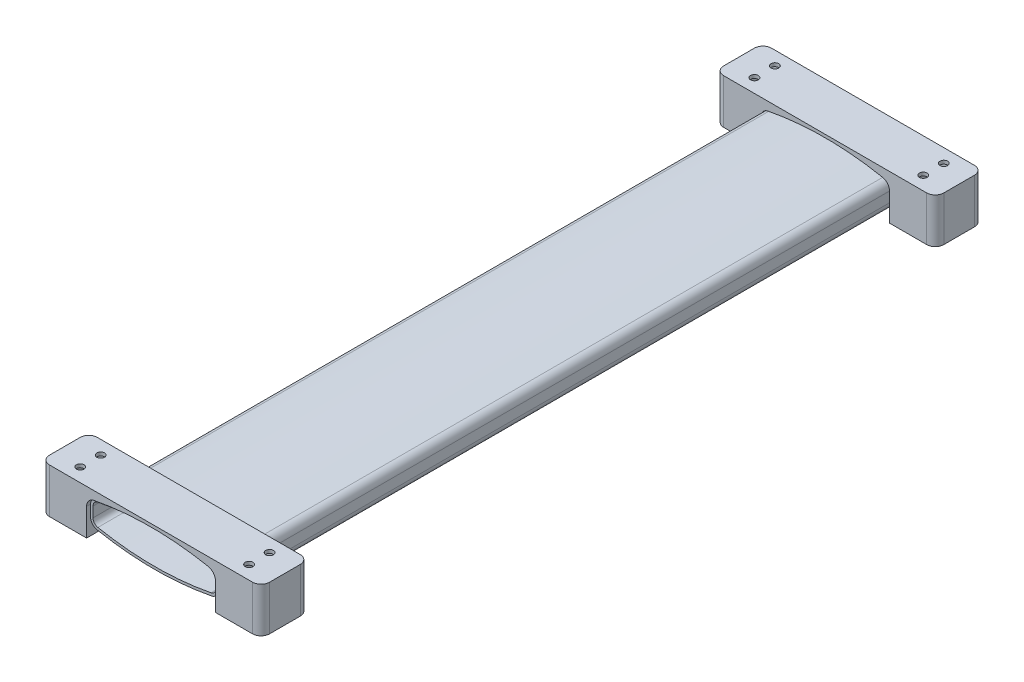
SolidWorks part; units mm, degrees
ref_plane "Front Plane" through (0, 0, 0) normal (0, 0, 1) x (1, 0, 0)
ref_plane "Top Plane" through (0, 0, 0) normal (0, 1, 0) x (1, 0, 0)
ref_plane "Right Plane" through (0, 0, 0) normal (1, 0, 0) x (0, 0, -1)
sketch "Sketch1" plane through (0, 0, 0) normal (0, 0, 1) x (1, 0, 0)
  line L0 (-26.375, 0) -> (26.375, 0) construction
  line L1 (-26.375, 11.125) -> (26.375, 11.125) construction
  line L2 (-26.375, -11.125) -> (26.375, -11.125) construction
  line L3 (-26.375, 9.625) -> (26.375, 9.625) construction
  line L4 (-26.375, -9.625) -> (26.375, -9.625) construction
  line L5 (-37.5, -7.0599) -> (-37.5, 7.0599)
  line L6 (37.5, -7.0599) -> (37.5, 7.0599)
  arc A0 (-26.375, 11.125) -> (-26.375, -11.125) centre (-26.375, 0) ccw construction
  arc A1 (26.375, -11.125) -> (26.375, 11.125) centre (26.375, 0) ccw construction
  arc A2 (26.375, -9.625) -> (26.375, 9.625) centre (26.375, 0) ccw construction
  arc A3 (-26.375, 9.625) -> (-26.375, -9.625) centre (-26.375, 0) ccw construction
  arc A4 (-37.5, -7.0599) -> (37.5, -7.0599) centre (0, 163.875) ccw
  arc A5 (37.5, 7.0599) -> (-37.5, 7.0599) centre (0, -163.875) ccw
  point P2 (0, 0)
  dimension "D2" = 75
  dimension "D4" = 350
  dimension "D1" = 22.25
  dimension "D3" = 1.5
extrude "Boss-Extrude1" add sketch "Sketch1" along normal blind 419.2
fillet "Fillet3" radius 5 4 edges at (37.5, -7.0599, 209.6) (37.5, 7.0599, 209.6) (-37.5, -7.0599, 209.6) (-37.5, 7.0599, 209.6)
shell "Shell2" thickness 1.5
sketch "Sketch2" plane through (0, 0, 0) normal (0, 0, -1) x (-1, 0, 0)
  line L8 (-39.5, 2.9895) -> (-39.5, -2.9895)
  line L9 (39.5, -2.9895) -> (39.5, 2.9895)
  line L10 (-39.5, 2.9895) -> (-39.5, -2.9895)
  line L11 (39.5, -2.9895) -> (39.5, 2.9895)
  arc A20 (-39.5, -2.9895) -> (-33.8382, -9.8604) centre (-32.5, -2.9895) ccw
  arc A21 (-33.8382, -9.8604) -> (33.8382, -9.8604) centre (0, 163.875) ccw
  arc A22 (33.8382, -9.8604) -> (39.5, -2.9895) centre (32.5, -2.9895) ccw
  arc A23 (39.5, 2.9895) -> (33.8382, 9.8604) centre (32.5, 2.9895) ccw
  arc A24 (33.8382, 9.8604) -> (-33.8382, 9.8604) centre (0, -163.875) ccw
  arc A25 (-33.8382, 9.8604) -> (-39.5, 2.9895) centre (-32.5, 2.9895) ccw
  arc A26 (-39.5, -2.9895) -> (-33.8382, -9.8604) centre (-32.5, -2.9895) ccw
  arc A27 (-33.8382, -9.8604) -> (33.8382, -9.8604) centre (0, 163.875) ccw
  arc A28 (33.8382, -9.8604) -> (39.5, -2.9895) centre (32.5, -2.9895) ccw
  arc A29 (39.5, 2.9895) -> (33.8382, 9.8604) centre (32.5, 2.9895) ccw
  arc A30 (33.8382, 9.8604) -> (-33.8382, 9.8604) centre (0, -163.875) ccw
  arc A31 (-33.8382, 9.8604) -> (-39.5, 2.9895) centre (-32.5, 2.9895) ccw
  dimension "D1" = 2
extrude "Boss-Extrude2" add sketch "Sketch2" along normal blind 2 separate body
sketch "Sketch3" plane through (0, 0, 0) normal (0, 0, 1) x (1, 0, 0)
  line L2 (-39.5, 2.9895) -> (-39.5, -2.9895)
  line L3 (-39.5, 2.9895) -> (-39.5, -2.9895)
  line L6 (39.5, -2.9895) -> (39.5, 2.9895)
  line L7 (39.5, -2.9895) -> (39.5, 2.9895)
  line L12 (37.75, -2.9895) -> (37.75, 2.9895)
  line L13 (-37.75, 2.9895) -> (-37.75, -2.9895)
  line L14 (37.75, -2.9895) -> (37.75, 2.9895)
  line L15 (-37.75, 2.9895) -> (-37.75, -2.9895)
  arc A2 (39.5, 2.9895) -> (33.8382, 9.8604) centre (32.5, 2.9895) ccw
  arc A3 (39.5, 2.9895) -> (33.8382, 9.8604) centre (32.5, 2.9895) ccw
  arc A14 (33.8382, 9.8604) -> (-33.8382, 9.8604) centre (0, -163.875) ccw
  arc A15 (33.8382, 9.8604) -> (-33.8382, 9.8604) centre (0, -163.875) ccw
  arc A16 (-33.8382, 9.8604) -> (-39.5, 2.9895) centre (-32.5, 2.9895) ccw
  arc A17 (-33.8382, 9.8604) -> (-39.5, 2.9895) centre (-32.5, 2.9895) ccw
  arc A18 (-39.5, -2.9895) -> (-33.8382, -9.8604) centre (-32.5, -2.9895) ccw
  arc A19 (-39.5, -2.9895) -> (-33.8382, -9.8604) centre (-32.5, -2.9895) ccw
  arc A20 (-33.8382, -9.8604) -> (33.8382, -9.8604) centre (0, 163.875) ccw
  arc A21 (-33.8382, -9.8604) -> (33.8382, -9.8604) centre (0, 163.875) ccw
  arc A22 (33.8382, -9.8604) -> (39.5, -2.9895) centre (32.5, -2.9895) ccw
  arc A23 (33.8382, -9.8604) -> (39.5, -2.9895) centre (32.5, -2.9895) ccw
  arc A28 (-33.5037, -8.1426) -> (33.5037, -8.1426) centre (0, 163.875) ccw
  arc A29 (33.5037, -8.1426) -> (37.75, -2.9895) centre (32.5, -2.9895) ccw
  arc A30 (37.75, 2.9895) -> (33.5037, 8.1426) centre (32.5, 2.9895) ccw
  arc A31 (33.5037, 8.1426) -> (-33.5037, 8.1426) centre (0, -163.875) ccw
  arc A32 (-33.5037, 8.1426) -> (-37.75, 2.9895) centre (-32.5, 2.9895) ccw
  arc A33 (-37.75, -2.9895) -> (-33.5037, -8.1426) centre (-32.5, -2.9895) ccw
  arc A34 (-33.5037, -8.1426) -> (33.5037, -8.1426) centre (0, 163.875) ccw
  arc A35 (33.5037, -8.1426) -> (37.75, -2.9895) centre (32.5, -2.9895) ccw
  arc A36 (37.75, 2.9895) -> (33.5037, 8.1426) centre (32.5, 2.9895) ccw
  arc A37 (33.5037, 8.1426) -> (-33.5037, 8.1426) centre (0, -163.875) ccw
  arc A38 (-33.5037, 8.1426) -> (-37.75, 2.9895) centre (-32.5, 2.9895) ccw
  arc A39 (-37.75, -2.9895) -> (-33.5037, -8.1426) centre (-32.5, -2.9895) ccw
  dimension "D1" = 0
  dimension "D2" = 0.25
extrude "Boss-Extrude3" add sketch "Sketch3" along normal blind 20
ref_plane "Plane2" through (0, 13.125, 0) normal (0, 1, 0) x (1, 0, 0)
sketch "Sketch4" plane through (0, 13.125, 0) normal (0, 1, 0) x (1, 0, 0)
  line L1 (64.5, 2) -> (-64.5, 2)
  line L3 (64.5, -26) -> (-64.5, -26)
  line L4 (-64.5, 2) -> (-64.5, -26)
  line L8 (64.5, -26) -> (64.5, 2)
  line L10 (0, 0) -> (0, 46.621) construction
  line L12 (33.8382, 2) -> (-33.8382, 2) construction
  dimension "D1" = 64.5
  dimension "D2" = 28
extrude "Boss-Extrude4" add sketch "Sketch4" against normal blind 26.25
fillet "Fillet2" radius 5 4 edges at (-64.5, 0, 26) (-64.5, 0, -2) (64.5, 0, -2) (64.5, 0, 26)
sketch "Sketch5" plane through (0, -13.125, 0) normal (0, -1, 0) x (-1, 0, 0)
  line L0 (64.5, -3) -> (64.5, -21) construction
  line L1 (64.5, -12) -> (-42.8137, -12) construction
  circle A0 centre (49.5, -6) radius 2.25
  circle A1 centre (49.5, -18) radius 2.25
  dimension "D1" = 4.5
  dimension "D3" = 6
  dimension "D2" = 49.5
extrude "Cut-Extrude1" cut sketch "Sketch5" against normal through all both and the other way through all
mirror "Mirror1" about plane through (0, 0, 0) normal (1, 0, 0) of "Cut-Extrude1"
sketch "Sketch6" plane through (0, 0, 0) normal (0, 1, 0) x (1, 0, 0)
  line L0 (-37.5, -209.6) -> (37.5, -209.6) construction
  line L3 (-37.5, 0) -> (-37.5, -419.2) construction
  line L4 (37.5, -419.2) -> (37.5, 0) construction
ref_plane "Plane1" through (0, 0, 209.6) normal (0, 0, -1) x (-1, 0, 0)
mirror "Mirror2" about plane through (0, 0, 209.6) normal (0, 0, -1)
sketch "Sketch7" plane through (0, 0, 421.2) normal (0, 0, 1) x (1, 0, 0)
  line L4 (37.75, -2.9895) -> (37.75, 2.9895)
  line L5 (-37.75, 2.9895) -> (-37.75, -2.9895)
  line L8 (37.75, -2.9895) -> (37.75, 2.9895)
  line L9 (-37.75, 2.9895) -> (-37.75, -2.9895)
  arc A14 (-33.5037, -8.1426) -> (33.5037, -8.1426) centre (0, 163.875) ccw
  arc A15 (33.5037, -8.1426) -> (37.75, -2.9895) centre (32.5, -2.9895) ccw
  arc A16 (37.75, 2.9895) -> (33.5037, 8.1426) centre (32.5, 2.9895) ccw
  arc A17 (33.5037, 8.1426) -> (-33.5037, 8.1426) centre (0, -163.875) ccw
  arc A18 (-33.5037, 8.1426) -> (-37.75, 2.9895) centre (-32.5, 2.9895) ccw
  arc A19 (-37.75, -2.9895) -> (-33.5037, -8.1426) centre (-32.5, -2.9895) ccw
  arc A20 (-33.5037, -8.1426) -> (33.5037, -8.1426) centre (0, 163.875) ccw
  arc A21 (33.5037, -8.1426) -> (37.75, -2.9895) centre (32.5, -2.9895) ccw
  arc A22 (37.75, 2.9895) -> (33.5037, 8.1426) centre (32.5, 2.9895) ccw
  arc A23 (33.5037, 8.1426) -> (-33.5037, 8.1426) centre (0, -163.875) ccw
  arc A24 (-33.5037, 8.1426) -> (-37.75, 2.9895) centre (-32.5, 2.9895) ccw
  arc A25 (-37.75, -2.9895) -> (-33.5037, -8.1426) centre (-32.5, -2.9895) ccw
  dimension "D1" = 0.25
extrude "Cut-Extrude2" cut sketch "Sketch7" against normal through all
sketch "Sketch9" plane through (0, 0, 0) normal (0, 0, 1) x (1, 0, 0)
  line L0 (37.75, 0) -> (37.75, -19.5552)
  line L1 (37.75, -19.5552) -> (-37.75, -19.5552)
  line L2 (-37.75, -19.5552) -> (-37.75, -2.3253)
  line L3 (-59.5, -13.125) -> (59.5, -13.125) construction
  line L7 (37.75, 0) -> (37.75, 7.2609)
  line L11 (-37.75, 7.2609) -> (-37.75, -2.3253)
  line L12 (37.75, -2.9895) -> (37.75, 2.9895) construction
  line L15 (-37.75, 2.9895) -> (-37.75, -2.9895) construction
  arc A0 (33.5037, 8.1426) -> (-33.5037, 8.1426) centre (0, -163.875) ccw construction
  arc A3 (37.75, 7.2609) -> (-37.75, 7.2609) centre (0, -163.875) ccw
  point P10 (37.75, 7.0599)
  point P13 (-39.0414, -2.3253)
  point P17 (-39.0414, 6.7139)
  dimension "D1" = 6.4302
extrude "Cut-Extrude3" cut sketch "Sketch9" along normal through all both and the other way through all
fillet "Fillet4" radius 5.25 2 edges at (37.75, 7.2609, 12) (-37.75, 7.2609, 12)
fillet "Fillet5" radius 5.25 2 edges at (37.75, 7.2609, 407.2) (-37.75, 7.2609, 407.2)
sketch "Sketch10" plane through (0, -13.125, 0) normal (0, -1, 0) x (1, 0, 0)
  line L8 (59.5, 24) -> (39.75, 24)
  line L9 (39.75, 24) -> (39.75, 0)
  line L10 (39.75, 0) -> (59.5, 0)
  line L11 (62.5, 3) -> (62.5, 21)
  line L12 (59.5, 24) -> (39.75, 24)
  line L13 (39.75, 24) -> (39.75, 0)
  line L14 (39.75, 0) -> (59.5, 0)
  line L15 (62.5, 3) -> (62.5, 21)
  line L20 (-59.5, 0) -> (-39.75, 0)
  line L21 (-39.75, 0) -> (-39.75, 24)
  line L22 (-39.75, 24) -> (-59.5, 24)
  line L23 (-62.5, 21) -> (-62.5, 3)
  line L24 (-59.5, 0) -> (-39.75, 0)
  line L25 (-39.75, 0) -> (-39.75, 24)
  line L26 (-39.75, 24) -> (-59.5, 24)
  line L27 (-62.5, 21) -> (-62.5, 3)
  arc A4 (59.5, 0) -> (62.5, 3) centre (59.5, 3) ccw
  arc A5 (62.5, 21) -> (59.5, 24) centre (59.5, 21) ccw
  arc A6 (59.5, 0) -> (62.5, 3) centre (59.5, 3) ccw
  arc A7 (62.5, 21) -> (59.5, 24) centre (59.5, 21) ccw
  arc A10 (-59.5, 24) -> (-62.5, 21) centre (-59.5, 21) ccw
  arc A11 (-62.5, 3) -> (-59.5, 0) centre (-59.5, 3) ccw
  arc A12 (-59.5, 24) -> (-62.5, 21) centre (-59.5, 21) ccw
  arc A13 (-62.5, 3) -> (-59.5, 0) centre (-59.5, 3) ccw
  dimension "D1" = 2
  dimension "D2" = 2
extrude "Cut-Extrude4" cut sketch "Sketch10" against normal offset from surface (24.25 mm away) 2
sketch "Sketch11" plane through (0, -13.125, 0) normal (0, -1, 0) x (1, 0, 0)
  line L8 (59.5, 419.2) -> (39.75, 419.2)
  line L9 (39.75, 419.2) -> (39.75, 395.2)
  line L10 (39.75, 395.2) -> (59.5, 395.2)
  line L11 (62.5, 398.2) -> (62.5, 416.2)
  line L12 (59.5, 419.2) -> (39.75, 419.2)
  line L13 (39.75, 419.2) -> (39.75, 395.2)
  line L14 (39.75, 395.2) -> (59.5, 395.2)
  line L15 (62.5, 398.2) -> (62.5, 416.2)
  line L20 (-59.5, 395.2) -> (-39.75, 395.2)
  line L21 (-39.75, 395.2) -> (-39.75, 419.2)
  line L22 (-39.75, 419.2) -> (-59.5, 419.2)
  line L23 (-62.5, 416.2) -> (-62.5, 398.2)
  line L24 (-59.5, 395.2) -> (-39.75, 395.2)
  line L25 (-39.75, 395.2) -> (-39.75, 419.2)
  line L26 (-39.75, 419.2) -> (-59.5, 419.2)
  line L27 (-62.5, 416.2) -> (-62.5, 398.2)
  arc A4 (59.5, 395.2) -> (62.5, 398.2) centre (59.5, 398.2) ccw
  arc A5 (62.5, 416.2) -> (59.5, 419.2) centre (59.5, 416.2) ccw
  arc A6 (59.5, 395.2) -> (62.5, 398.2) centre (59.5, 398.2) ccw
  arc A7 (62.5, 416.2) -> (59.5, 419.2) centre (59.5, 416.2) ccw
  arc A10 (-59.5, 419.2) -> (-62.5, 416.2) centre (-59.5, 416.2) ccw
  arc A11 (-62.5, 398.2) -> (-59.5, 395.2) centre (-59.5, 398.2) ccw
  arc A12 (-59.5, 419.2) -> (-62.5, 416.2) centre (-59.5, 416.2) ccw
  arc A13 (-62.5, 398.2) -> (-59.5, 395.2) centre (-59.5, 398.2) ccw
  dimension "D1" = 2
  dimension "D2" = 2
extrude "Cut-Extrude5" cut sketch "Sketch11" against normal offset from surface (24.25 mm away) 2
sketch "Sketch12" plane through (0, 0, -2) normal (0, 0, -1) x (-1, 0, 0)
  line L0 (-37.75, -13.125) -> (-37.75, 2.9895) construction
  line L1 (37.75, 2.9895) -> (37.75, -13.125) construction
  line L2 (-37.75, -13.125) -> (-37.75, 2.9895)
  line L3 (37.75, 2.9895) -> (37.75, -13.125)
  line L6 (-37.75, -13.125) -> (37.75, -13.125)
  arc A0 (-33.5037, 8.1426) -> (-37.75, 2.9895) centre (-32.5, 2.9895) ccw construction
  arc A1 (33.5037, 8.1426) -> (-33.5037, 8.1426) centre (0, -163.875) ccw construction
  arc A2 (37.75, 2.9895) -> (33.5037, 8.1426) centre (32.5, 2.9895) ccw construction
  arc A3 (-33.5037, 8.1426) -> (-37.75, 2.9895) centre (-32.5, 2.9895) ccw
  arc A4 (33.5037, 8.1426) -> (-33.5037, 8.1426) centre (0, -163.875) ccw
  arc A5 (37.75, 2.9895) -> (33.5037, 8.1426) centre (32.5, 2.9895) ccw
  point P7 (36.9251, -13.125)
extrude "Boss-Extrude5" add sketch "Sketch12" against normal blind 2
